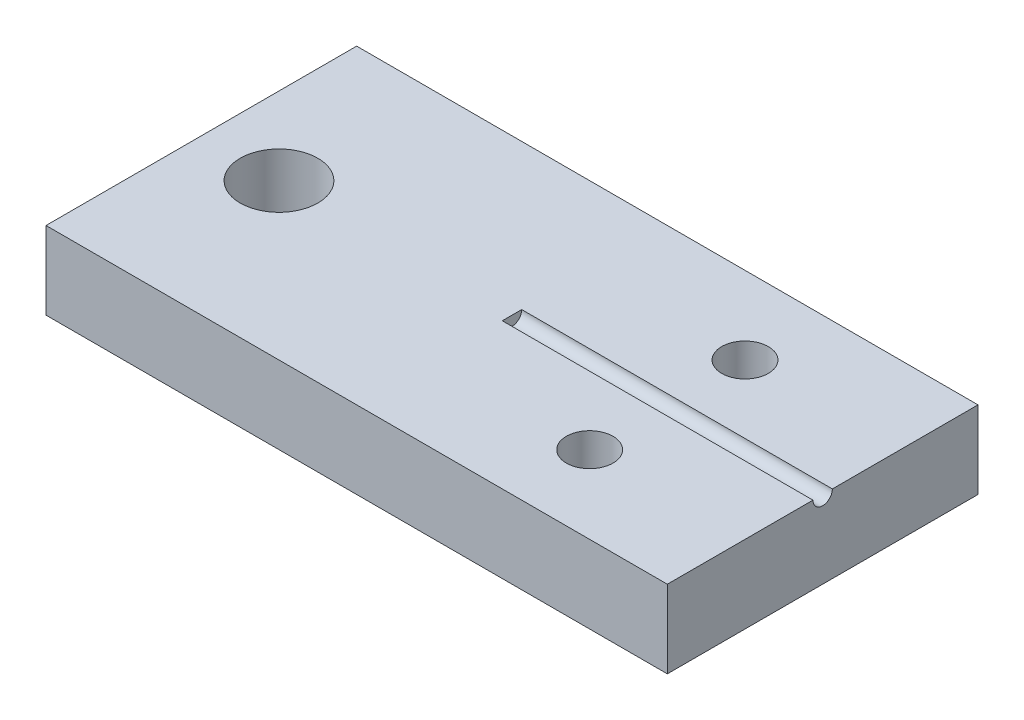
SolidWorks part; units mm, degrees
ref_plane "Front Plane" through (0, 0, 0) normal (0, 0, 1) x (1, 0, 0)
ref_plane "Top Plane" through (0, 0, 0) normal (0, 1, 0) x (1, 0, 0)
ref_plane "Right Plane" through (0, 0, 0) normal (1, 0, 0) x (0, 0, -1)
sketch "Sketch1" plane through (0, 0, 0) normal (0, 1, 0) x (1, 0, 0)
  line L0 (38.1, 19.05) -> (38.1, 6.35) construction
  line L1 (0, 0) -> (50.8, 0)
  line L2 (0, 0) -> (0, 25.4)
  line L3 (0, 25.4) -> (50.8, 25.4)
  line L4 (50.8, 0) -> (50.8, 25.4)
  line L5 (38.1, 12.7) -> (50.8, 12.7) construction
  line L6 (6.35, 12.7) -> (0, 12.7) construction
  circle A0 centre (38.1, 6.35) radius 1.905
  circle A1 centre (38.1, 19.05) radius 1.905
  circle A2 centre (6.35, 12.7) radius 3.175
  dimension "D3" = 6.35
  dimension "D4" = 12.7
  dimension "D5" = 3.81
  dimension "D1" = 50.8
  dimension "D2" = 25.4
  dimension "D6" = 12.7
  dimension "D7" = 6.35
extrude "Boss-Extrude1" add sketch "Sketch1" along normal blind 6.35
sketch "Sketch2" plane through (50.8, 0, 0) normal (1, 0, 0) x (0, 0, -1)
  line L0 (0, 6.35) -> (25.4, 6.35) construction
  circle A0 centre (12.7, 6.35) radius 0.7937
  dimension "D1" = 1.5875
extrude "Cut-Extrude1" cut sketch "Sketch2" against normal blind 25.4
